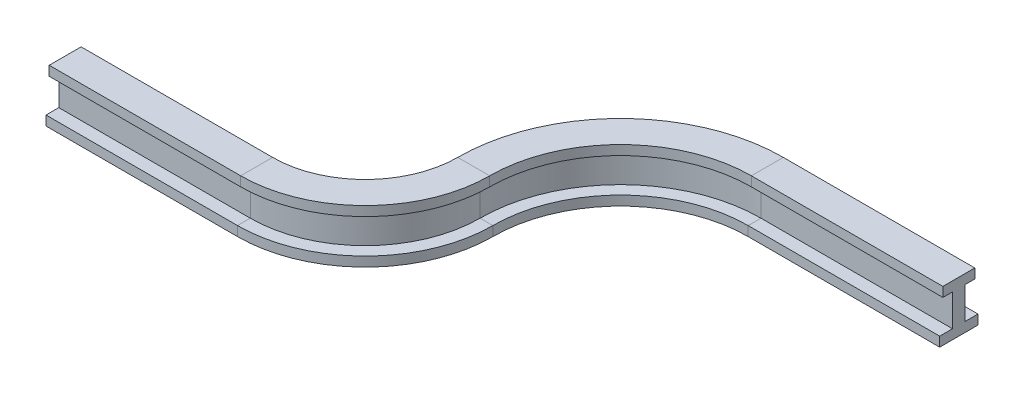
SolidWorks part; units mm, degrees
ref_plane "Front Plane" through (0, 0, 0) normal (0, 0, 1) x (1, 0, 0)
ref_plane "Top Plane" through (0, 0, 0) normal (0, 1, 0) x (1, 0, 0)
ref_plane "Right Plane" through (0, 0, 0) normal (1, 0, 0) x (0, 0, -1)
sketch "Sketch1" plane through (0, 0, 0) normal (0, 1, 0) x (1, 0, 0)
  line L0 (0, 0) -> (-30, 0)
  line L1 (-70, -40) -> (-100, -40)
  arc A0 (-30, 0) -> (-50, -20) centre (-30, -20) ccw
  arc A1 (-50, -20) -> (-70, -40) centre (-70, -20) cw
  dimension "D2" = 20
  dimension "D1" = 100
sketch "Sketch2" plane through (0, 0, 0) normal (1, 0, 0) x (0, 0, -1)
  line L1 (2, 1.5) -> (2, 6.5)
  line L2 (2, 6.5) -> (0.5, 6.5)
  line L3 (0.5, 6.5) -> (0.5, 8)
  line L4 (0.5, 8) -> (5.5, 8)
  line L5 (5.5, 8) -> (5.5, 6.5)
  line L6 (5.5, 6.5) -> (4, 6.5)
  line L7 (4, 6.5) -> (4, 1.5)
  line L8 (6, 1.5) -> (4, 1.5)
  line L9 (6, 0) -> (6, 1.5)
  line L10 (0, 0) -> (6, 0)
  line L11 (0, 1.5) -> (0, 0)
  line L12 (2, 1.5) -> (0, 1.5)
  line L13 (3, 8) -> (3, 0) construction
  dimension "D1" = 8
  dimension "D2" = 5
  dimension "D3" = 5
  dimension "D4" = 6
  dimension "D5" = 1.5
  dimension "D6" = 2
sweep "Sweep1" add profiles "Sketch2" path "Sketch1"
